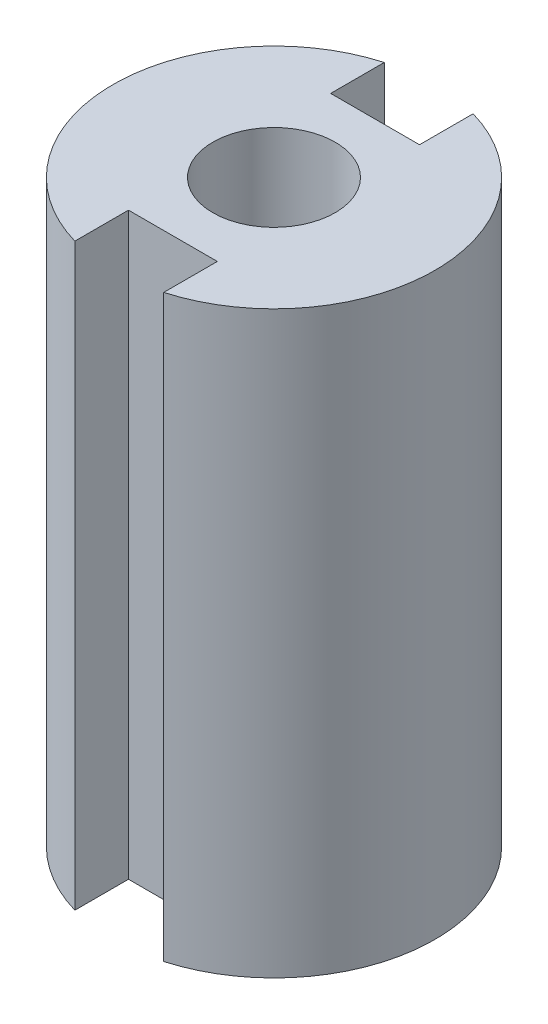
SolidWorks part; units mm, degrees
ref_plane "Front Plane" through (0, 0, 0) normal (0, 0, 1) x (1, 0, 0)
ref_plane "Top Plane" through (0, 0, 0) normal (0, 1, 0) x (1, 0, 0)
ref_plane "Right Plane" through (0, 0, 0) normal (1, 0, 0) x (0, 0, -1)
sketch "Sketch1" plane through (0, 0, 0) normal (0, 1, 0) x (1, 0, 0)
  circle A0 centre (0, 0) radius 6.35
  dimension "D1" = 12.7
extrude "Extrude1" add sketch "Sketch1" along normal blind 22.86
sketch "Sketch2" plane through (0, 22.86, 0) normal (0, 1, 0) x (-1, 0, 0)
  circle A0 centre (0, 0) radius 2.413
  dimension "D1" = 4.826
extrude "Cut-Extrude1" cut sketch "Sketch2" against normal blind 21.59
sketch "Sketch3" plane through (0, 0, 0) normal (0, -1, 0) x (1, 0, 0)
  circle A0 centre (0, 0) radius 1.7272
  dimension "D1" = 3.4544
extrude "Cut-Extrude2" cut sketch "Sketch3" against normal blind 2.54
sketch "Sketch4" plane through (0, 22.86, 0) normal (0, 1, 0) x (-1, 0, 0)
  line L0 (0, 0) -> (-6.35, 0) construction
  line L1 (0, 0) -> (0, 3.9878) construction
  line L2 (1.7526, 3.9878) -> (-1.7526, 3.9878)
  line L3 (-1.7526, 3.9878) -> (-1.7526, 6.7131)
  line L4 (-1.7526, 6.7131) -> (1.7526, 6.7131)
  line L5 (1.7526, 3.9878) -> (1.7526, 6.7131)
  line L6 (1.7526, -3.9878) -> (1.7526, -6.7131)
  line L7 (-1.7526, -6.7131) -> (1.7526, -6.7131)
  line L8 (-1.7526, -3.9878) -> (-1.7526, -6.7131)
  line L9 (1.7526, -3.9878) -> (-1.7526, -3.9878)
  circle A0 centre (0, 0) radius 6.35 construction
  point P10 (0, 6.7131)
  point P15 (0, -6.7131)
  dimension "D1" = 3.9878
  dimension "D2" = 1.7526
extrude "Cut-Extrude3" cut sketch "Sketch4" against normal through all
